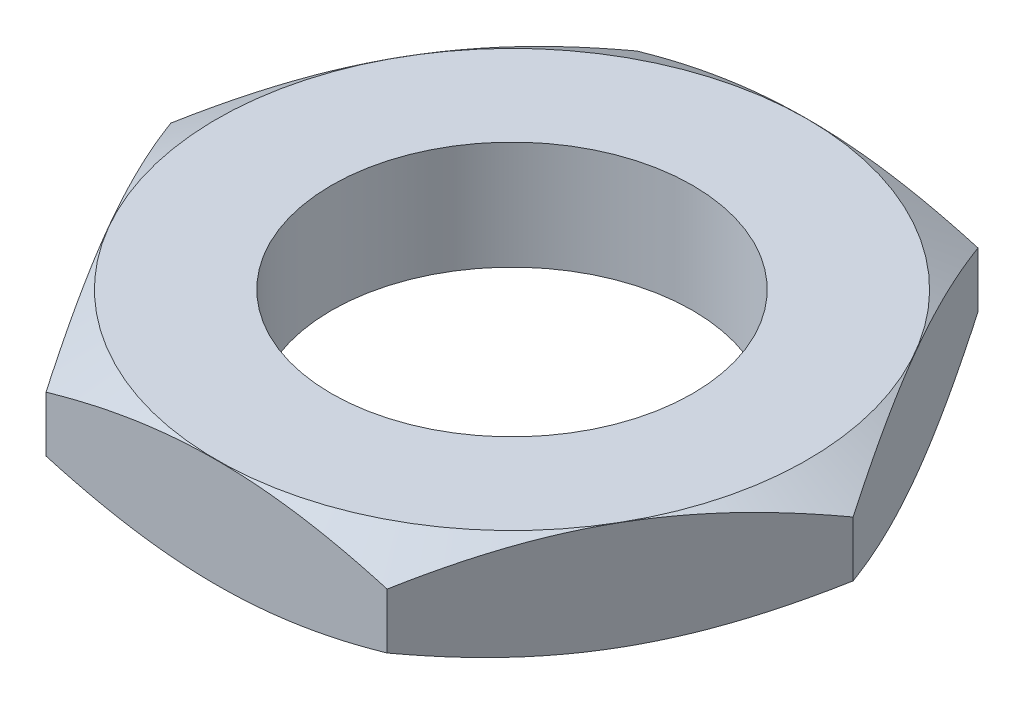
SolidWorks part; units mm, degrees
ref_plane "Front" through (0, 0, 0) normal (0, 0, 1) x (1, 0, 0)
ref_plane "Top" through (0, 0, 0) normal (0, 1, 0) x (1, 0, 0)
ref_plane "Right" through (0, 0, 0) normal (1, 0, 0) x (0, 0, -1)
sketch "Sketch2" plane through (0, 0, 0) normal (0, 1, 0) x (1, 0, 0)
  line L1 (9.45, 0) -> (4.725, 8.1839)
  line L2 (4.725, 8.1839) -> (-4.725, 8.1839)
  line L3 (-4.725, 8.1839) -> (-9.45, 0)
  line L4 (-9.45, 0) -> (-4.725, -8.1839)
  line L5 (-4.725, -8.1839) -> (4.725, -8.1839)
  line L6 (4.725, -8.1839) -> (9.45, 0)
  circle A0 centre (0, 0) radius 9.45 construction
  dimension "D1" = 18.9
extrude "Extrude1" add sketch "Sketch2" along normal blind 3
sketch "Sketch3" plane through (0, 3, 0) normal (0, 1, 0) x (-1, 0, 0)
  circle A0 centre (0, 0) radius 5
extrude "Cut-Extrude1" cut sketch "Sketch3" against normal through all
sketch "Sketch6" plane through (0, 0, 0) normal (0, 0, 1) x (1, 0, 0)
  line L0 (0, 0) -> (0, 5.0587)
  line L1 (11.1171, 3) -> (11.1171, 0)
  line L2 (8.18, 3) -> (9.9313, 1.9889)
  line L4 (8.18, 0) -> (10.0021, 1.052)
  line L5 (8.18, 3) -> (11.1171, 3)
  line L7 (9.9313, 1.9889) -> (10.0021, 1.052)
  line L8 (11.1171, 0) -> (8.18, 0)
  dimension "D1" = 3
  dimension "D2" = 8.18
revolve "Cut-Revolve1" cut sketch "Sketch6" angle 360 about L0
